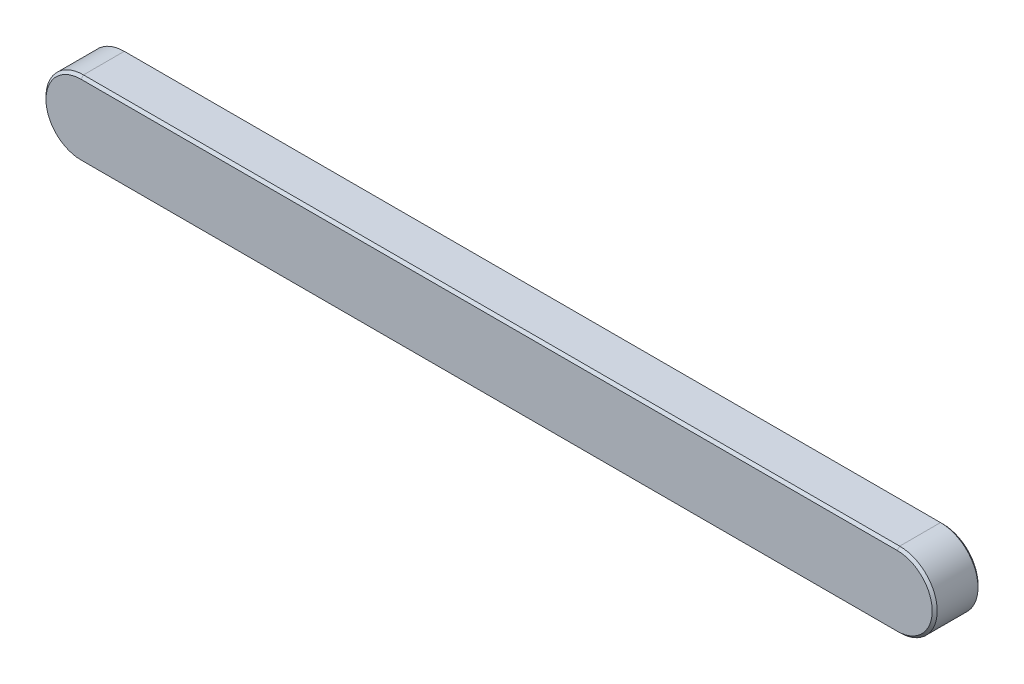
SolidWorks part; units mm, degrees
ref_plane "Face" through (0, 0, 0) normal (0, 0, 1) x (1, 0, 0)
ref_plane "Dessus" through (0, 0, 0) normal (0, 1, 0) x (1, 0, 0)
ref_plane "Cote" through (0, 0, 0) normal (1, 0, 0) x (0, 0, -1)
sketch "Esquisse1" plane through (0, 0, 0) normal (0, 0, 1) x (1, 0, 0)
  line L1 (0, 0) -> (196, 0)
  line L3 (0, 18) -> (196, 18)
  arc A0 (196, 18) -> (196, 0) centre (196, 9) cw
  arc A1 (0, 0) -> (0, 18) centre (0, 9) cw
  dimension "D1" = 214
  dimension "D2" = 18
extrude "Base-Extrusion" add sketch "Esquisse1" along normal blind 11
chamfer "Chanfrein1" distance 0.6 angle 45 8 edges at (205, 9, 11) (98, 18, 11) (-9, 9, 11) (98, 18, 0) (205, 9, 0) (98, 0, 0) (-9, 9, 0) (98, 0, 11)
